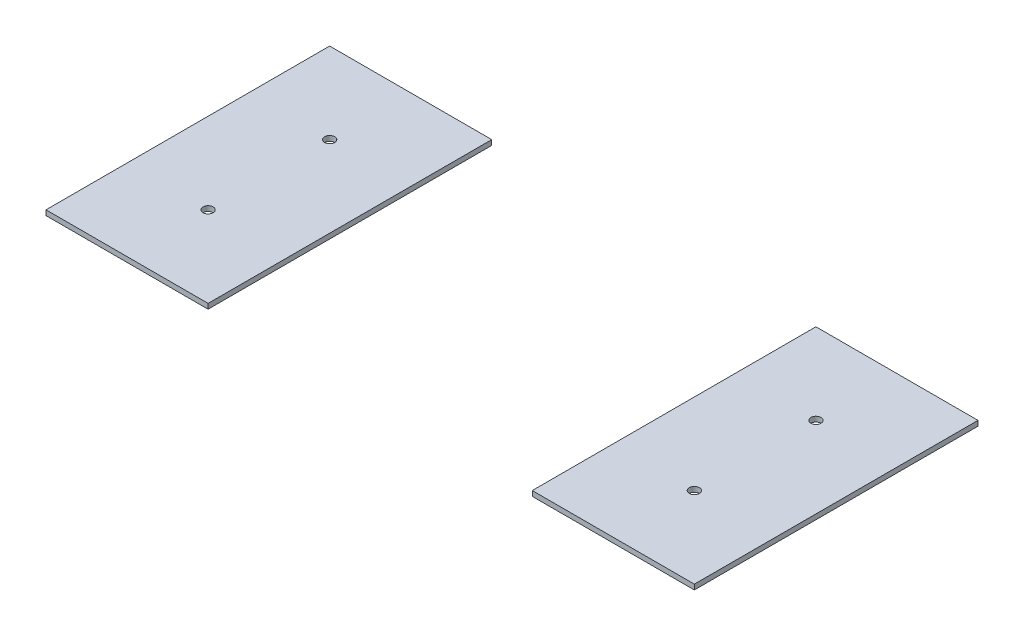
SolidWorks part; units mm, degrees
ref_plane "Front Plane" through (0, 0, 0) normal (0, 0, 1) x (1, 0, 0)
ref_plane "Top Plane" through (0, 0, 0) normal (0, 1, 0) x (1, 0, 0)
ref_plane "Right Plane" through (0, 0, 0) normal (1, 0, 0) x (0, 0, -1)
sketch "Sketch2" plane through (0, 0, 0) normal (0, 0, 1) x (1, 0, 0)
  line L0 (-203.2, 0) -> (203.2, 0)
  line L1 (203.2, 0) -> (203.2, 3.175)
  line L2 (203.2, 3.175) -> (-203.2, 3.175)
  line L3 (-203.2, 3.175) -> (-203.2, 0)
  point P3 (0, 0)
  dimension "D1" = 406.4
  dimension "D2" = 3.175
extrude "Boss-Extrude1" add sketch "Sketch2" along normal mid plane 355.6
sketch "Sketch4" plane through (0, 3.175, 0) normal (0, 1, 0) x (1, 0, 0)
  line L0 (-203.2, 177.8) -> (-203.2, 88.9)
  line L1 (-203.2, -177.8) -> (-203.2, 177.8) construction
  line L2 (-203.2, 88.9) -> (203.2, 88.9)
  line L3 (203.2, -177.8) -> (203.2, 177.8) construction
  line L4 (203.2, 88.9) -> (203.2, 177.8)
  line L5 (203.2, 177.8) -> (-203.2, 177.8) construction
  line L6 (203.2, 177.8) -> (-203.2, 177.8)
  line L7 (-279.5605, 0) -> (303.0136, 0) construction
  line L8 (203.2, -177.8) -> (-203.2, -177.8)
  line L9 (203.2, -88.9) -> (203.2, -177.8)
  line L10 (-203.2, -88.9) -> (203.2, -88.9)
  line L11 (-203.2, -177.8) -> (-203.2, -88.9)
  dimension "D1" = 88.9
extrude "Cut-Extrude2" cut sketch "Sketch4" against normal up to next
sketch "Sketch5" plane through (0, 3.175, 0) normal (0, 1, 0) x (1, 0, 0)
  line L0 (0, 124.2776) -> (0, -126.8476) construction
  line L1 (-203.2, -88.9) -> (-203.2, 88.9) construction
  line L2 (-203.2, 88.9) -> (203.2, 88.9) construction
  line L3 (203.2, -88.9) -> (-203.2, -88.9) construction
  circle A0 centre (-152.4, 38.1) radius 3.175
  circle A1 centre (-152.4, -38.1) radius 3.175
  circle A2 centre (152.4, -38.1) radius 3.175
  circle A3 centre (152.4, 38.1) radius 3.175
  dimension "D1" = 6.35
  dimension "D2" = 6.35
  dimension "D3" = 50.8
  dimension "D4" = 50.8
  dimension "D5" = 50.8
extrude "Cut-Extrude3" cut sketch "Sketch5" against normal through all
sketch "Sketch6" plane through (0, 3.175, 0) normal (0, 1, 0) x (1, 0, 0)
  line L0 (-101.6, 88.9) -> (-101.6, -88.9)
  line L1 (-203.2, 88.9) -> (203.2, 88.9) construction
  line L2 (203.2, -88.9) -> (-203.2, -88.9) construction
  line L3 (-101.6, -88.9) -> (101.6, -88.9)
  line L4 (101.6, -88.9) -> (101.6, 88.9)
  line L5 (101.6, 88.9) -> (-101.6, 88.9)
  point P6 (0, 88.9)
  dimension "D1" = 203.2
extrude "Cut-Extrude4" cut sketch "Sketch6" against normal through all
